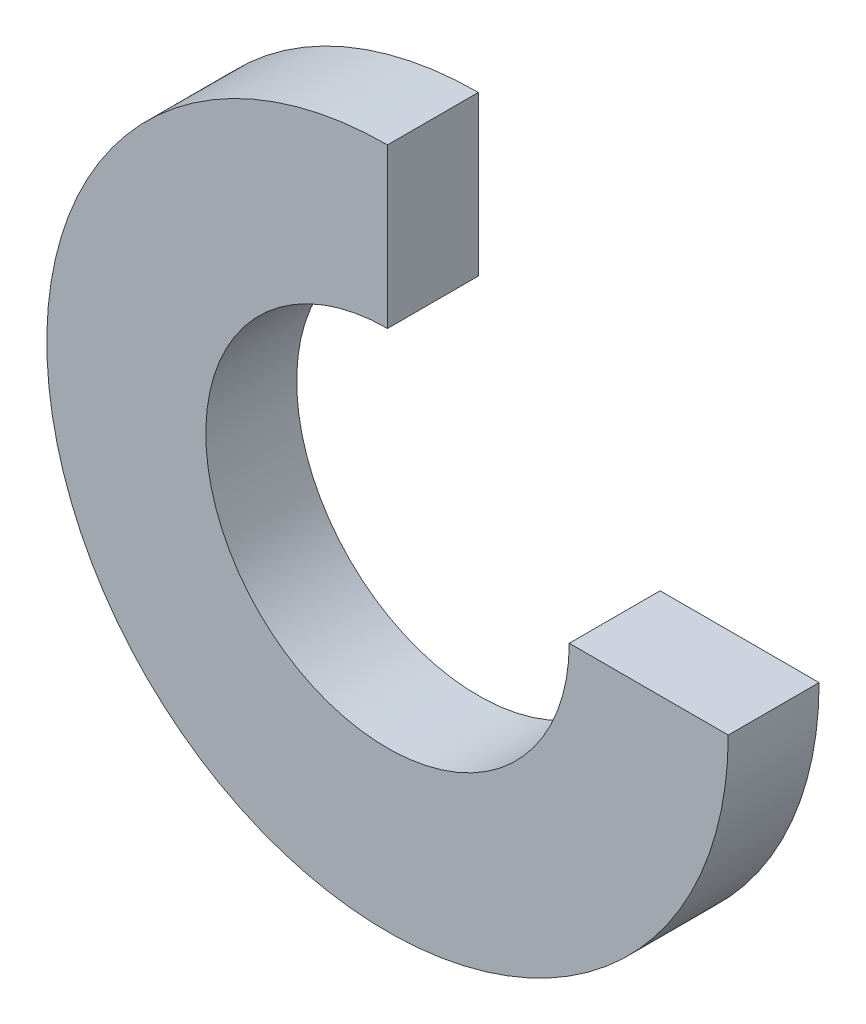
SolidWorks part; units mm, degrees
ref_plane "Face" through (0, 0, 0) normal (0, 0, 1) x (1, 0, 0)
ref_plane "Dessus" through (0, 0, 0) normal (0, 1, 0) x (1, 0, 0)
ref_plane "Droite" through (0, 0, 0) normal (1, 0, 0) x (0, 0, -1)
sketch "Esquisse1" plane through (0, 0, 0) normal (0, 0, 1) x (1, 0, 0)
  line L0 (0, 4) -> (0, 7.5)
  line L1 (4, 0) -> (7.5, 0)
  arc A0 (0, 7.5) -> (7.5, 0) centre (0, 0) ccw
  arc A1 (0, 4) -> (4, 0) centre (0, 0) ccw
  dimension "D1" = 8
  dimension "D2" = 15
extrude "Base-Extrusion" add sketch "Esquisse1" along normal blind 2
